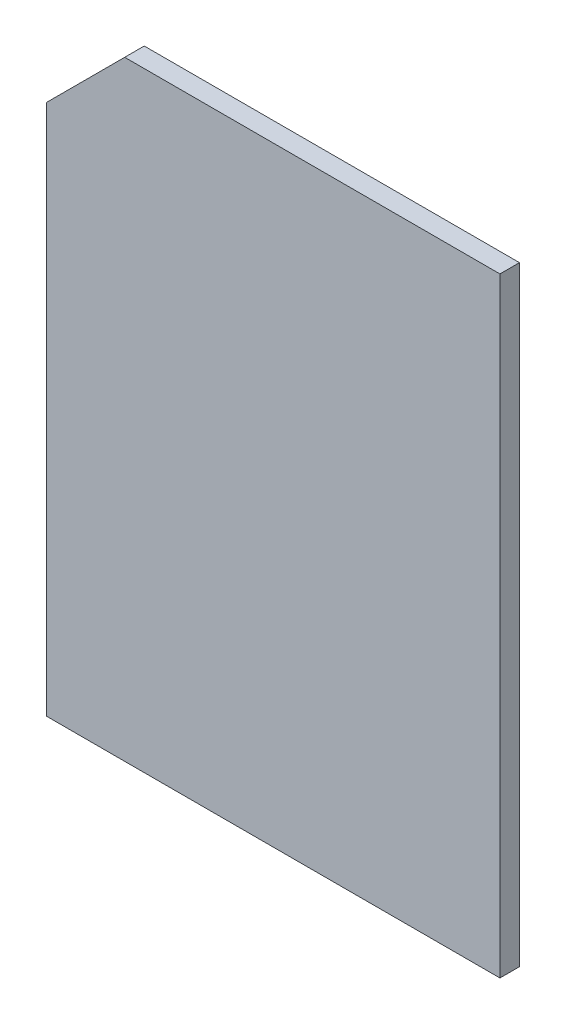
SolidWorks part; units mm, degrees
ref_plane "Front Plane" through (0, 0, 0) normal (0, 0, 1) x (1, 0, 0)
ref_plane "Top Plane" through (0, 0, 0) normal (0, 1, 0) x (1, 0, 0)
ref_plane "Right Plane" through (0, 0, 0) normal (1, 0, 0) x (0, 0, -1)
sketch "Sketch1" plane through (0, 0, 0) normal (0, 0, 1) x (1, 0, 0)
  line L1 (0, 0) -> (-36.83, 0)
  line L2 (0, 0) -> (0, 49.53)
  line L3 (0, 49.53) -> (-30.48, 49.53)
  line L4 (-36.83, 0) -> (-36.83, 43.18)
  line L7 (-30.48, 49.53) -> (-36.83, 43.18)
  dimension "D1" = 45
  dimension "D2" = 49.53
  dimension "D3" = 36.83
  dimension "D4" = 6.35
extrude "Boss-Extrude1" add sketch "Sketch1" along normal blind 1.5875
